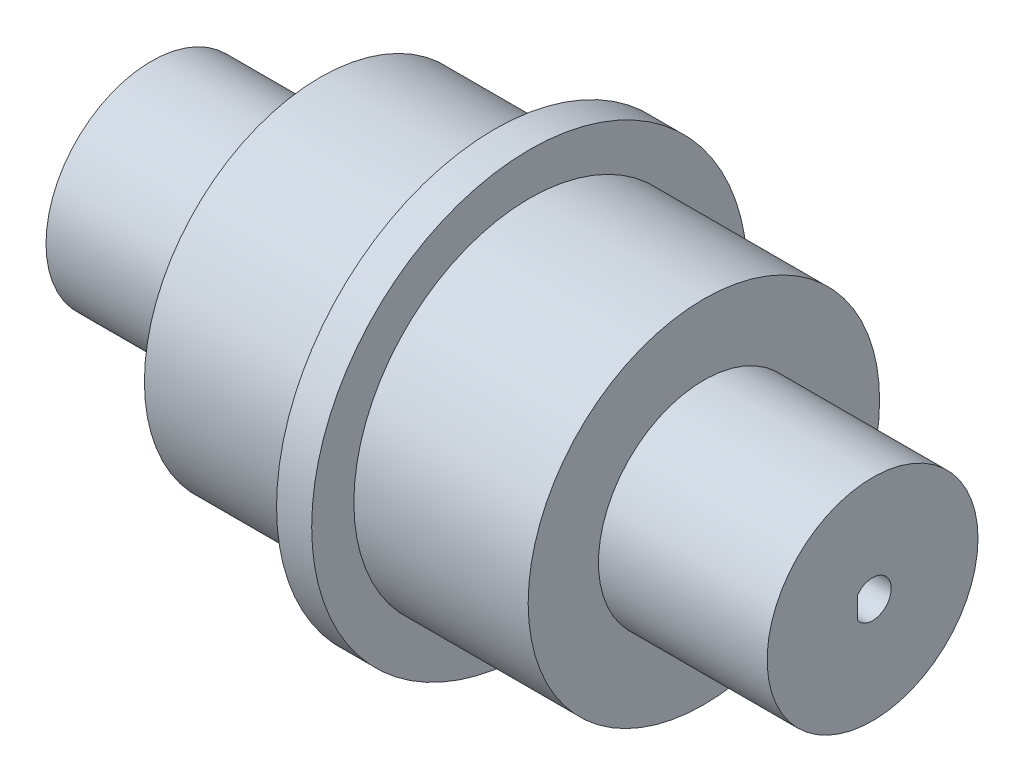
SolidWorks part; units mm, degrees
ref_plane "Alzado" through (0, 0, 0) normal (0, 0, 1) x (1, 0, 0)
ref_plane "Planta" through (0, 0, 0) normal (0, 1, 0) x (1, 0, 0)
ref_plane "Vista lateral" through (0, 0, 0) normal (1, 0, 0) x (0, 0, -1)
sketch "Croquis1" plane through (0, 0, 0) normal (1, 0, 0) x (0, 0, -1)
  circle A0 centre (0, 0) radius 25
  dimension "D1" = 50
extrude "Saliente-Extruir1" add sketch "Croquis1" along normal mid plane 54.6
ref_plane "Plano4" through (-27.3, 0, 0) normal (-1, 0, 0) x (0, 0, 1)
sketch "Croquis2" plane through (-27.3, 0, 0) normal (-1, 0, 0) x (0, 0, 1)
  circle A0 centre (0, 0) radius 15
  dimension "D1" = 30
extrude "Saliente-Extruir2" add sketch "Croquis2" along normal blind 24
ref_plane "Plano5" through (27.3, 0, 0) normal (1, 0, 0) x (0, 0, -1)
sketch "Croquis3" plane through (27.3, 0, 0) normal (1, 0, 0) x (0, 0, -1)
  circle A0 centre (0, 0) radius 15
  dimension "D1" = 30
extrude "Saliente-Extruir3" add sketch "Croquis3" along normal blind 24
ref_plane "Plano6" through (51.3, 0, 0) normal (1, 0, 0) x (0, 0, -1)
sketch "Croquis4" plane through (51.3, 0, 0) normal (1, 0, 0) x (0, 0, -1)
  line L1 (0, 0) -> (0, -0.5899) construction
  line L4 (-2.15, 1.5492) -> (-2.15, -1.5492)
  arc A3 (-2.15, -1.5492) -> (-2.15, 1.5492) centre (0, 0) ccw
extrude "Cortar-Extruir1" cut sketch "Croquis4" against normal through all both and the other way through all
ref_plane "Plano7" through (0, 0, 15.15) normal (0, 0, -1) x (-1, 0, 0)
sketch "Croquis5" plane through (0, 0, 0) normal (1, 0, 0) x (0, 0, -1)
  circle A0 centre (0, 0) radius 31
  circle A1 centre (0, 0) radius 25 construction
  dimension "D1" = 6
extrude "Saliente-Extruir4" add sketch "Croquis5" along normal mid plane 5
